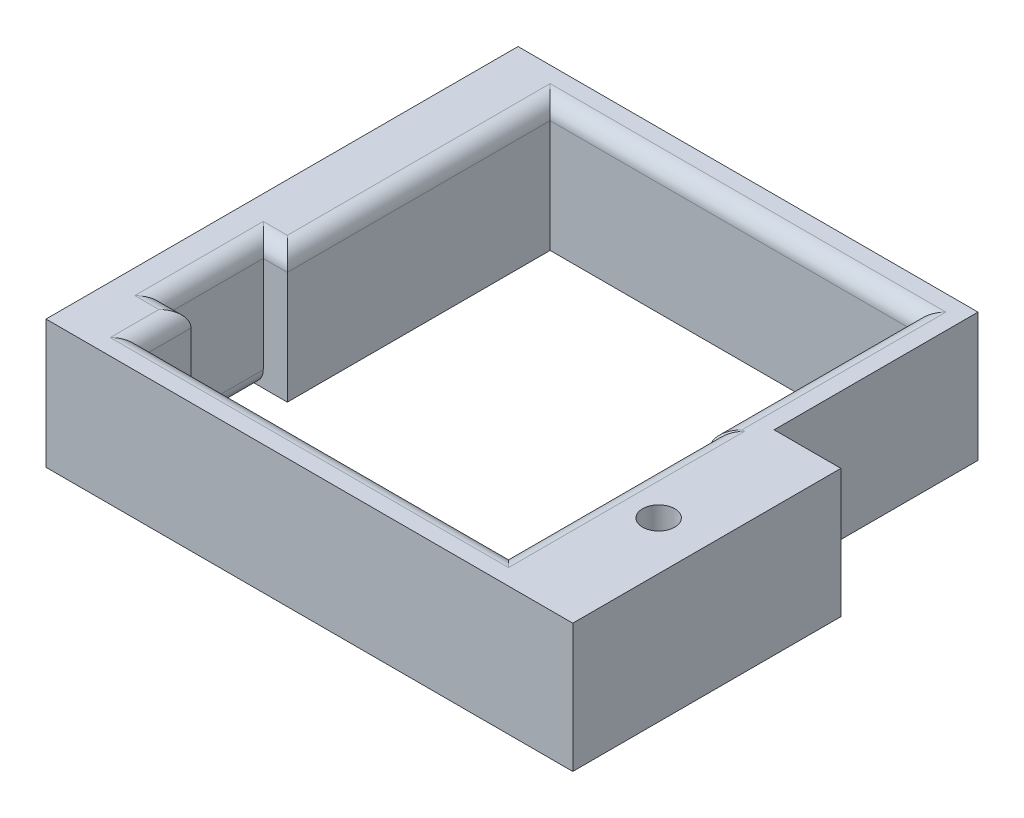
SolidWorks part; units mm, degrees
ref_plane "Front Plane" through (0, 0, 0) normal (0, 0, 1) x (1, 0, 0)
ref_plane "Top Plane" through (0, 0, 0) normal (0, 1, 0) x (1, 0, 0)
ref_plane "Right Plane" through (0, 0, 0) normal (1, 0, 0) x (0, 0, -1)
sketch "Sketch1" plane through (0, 0, 0) normal (0, 1, 0) x (1, 0, 0)
  line L0 (0, 0) -> (0, 29.4)
  line L1 (0, 29.4) -> (28.65, 29.4)
  line L2 (28.65, 29.4) -> (28.65, 16.7)
  line L3 (28.65, 16.7) -> (32.81, 16.7)
  line L4 (32.81, 16.7) -> (32.81, 0)
  line L5 (32.81, 0) -> (0, 0)
  line L6 (26.81, 6.7391) -> (26.81, 14.7)
  line L7 (26.81, 14.7) -> (26.65, 14.7)
  line L8 (26.65, 14.7) -> (26.65, 27.4)
  line L9 (26.65, 27.4) -> (4, 27.4)
  line L10 (4, 27.4) -> (4, 2)
  line L11 (4, 2) -> (26.81, 2)
  line L12 (26.81, 2) -> (26.81, 6.7391)
  dimension "D1" = 12.7
  dimension "D2" = 4
  dimension "D3" = 22.65
  dimension "D4" = 29.4
  dimension "D5" = 6
  dimension "D6" = 2
  dimension "D7" = 2
  dimension "D8" = 2
  dimension "D9" = 2
  dimension "D10" = 32.81
extrude "Boss-Extrude1" add sketch "Sketch1" along normal blind 8
sketch "Sketch2" plane through (0, 8, 0) normal (0, 1, 0) x (1, 0, 0)
  line L0 (26.81, 14.7) -> (32.81, 14.7)
  line L1 (32.81, 0) -> (32.81, 16.7) construction
  line L2 (32.81, 14.7) -> (32.81, 2)
  line L3 (32.81, 2) -> (26.81, 2)
  line L4 (26.81, 2) -> (26.81, 14.7)
  line L5 (26.81, 14.7) -> (32.81, 2)
  line L6 (32.81, 14.7) -> (26.81, 2)
  circle A0 centre (29.81, 8.35) radius 1
  dimension "D1" = 2
extrude "Cut-Extrude1" cut sketch "Sketch2" against normal through all contours L5 A0 L6 | L6 A0 L5 | L5 A0 L6 | L6 A0 L5
sketch "Sketch3" plane through (0, 8, 0) normal (0, 1, 0) x (1, 0, 0)
  line L0 (4, 5.0315) -> (2.5, 5.0315)
  line L7 (0, 29.4) -> (0, 0) construction
  line L8 (2.5, 11.0315) -> (2.5, 5.0315)
  line L9 (0, 5.75) -> (0, 10.25)
  line L10 (4, 5.0315) -> (4, 11.0315)
  line L11 (4, 27.4) -> (4, 2) construction
  line L12 (-1.5, 10.25) -> (-1.5, 5.75)
  line L14 (4, 11.0315) -> (2.5, 11.0315)
  line L15 (0, 10.25) -> (-1.5, 10.25)
  line L16 (0, 5.75) -> (-1.5, 5.75)
  point P0 (29.81, 8.35)
  dimension "D1" = 6
  dimension "D2" = 1.5
  dimension "D3" = 1.5
  dimension "D4" = 1.5
  dimension "D5" = 1.5
extrude "Cut-Extrude2" cut sketch "Sketch3" against normal through all
fillet "Fillet1" radius 1 10 edges at (3.25, 8, -5.0315) (2.5, 8, -8.0315) (3.25, 8, -11.0315) (4, 8, -3.5158) (15.405, 8, -2) (26.73, 8, -14.7) (26.81, 8, -8.35) (26.65, 8, -21.05) (15.325, 8, -27.4) (4, 8, -19.2158)
fillet "Fillet2" radius 1 1 edges at (2.5, 0, -8.0315)
